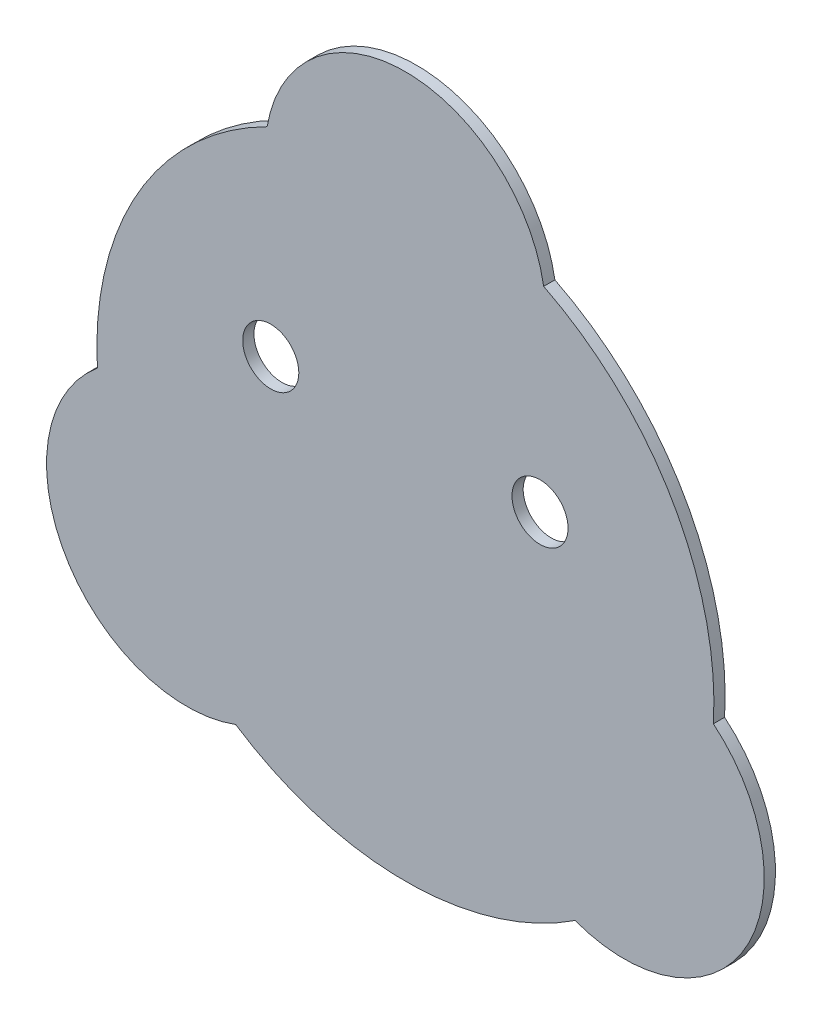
SolidWorks part; units mm, degrees
ref_plane "Спереди" through (0, 0, 0) normal (0, 0, 1) x (1, 0, 0)
ref_plane "Сверху" through (0, 0, 0) normal (0, 1, 0) x (1, 0, 0)
ref_plane "Справа" through (0, 0, 0) normal (1, 0, 0) x (0, 0, -1)
sketch "Эскиз1" plane through (0, 0, -2001) normal (0, 0, 1) x (1, 0, 0)
  circle A21 centre (-422.1166, 1329.8801) radius 2.5 construction
  circle A22 centre (-446.1166, 1329.8801) radius 2.5 construction
  circle A23 centre (-422.1166, 1329.8801) radius 2.5
  circle A24 centre (-446.1166, 1329.8801) radius 2.5
  arc A27 (-449.2438, 1299.9146) -> (-418.9894, 1299.9146) centre (-434.1166, 1322.8801) ccw
  arc A28 (-418.9894, 1299.9146) -> (-406.6642, 1321.2624) centre (-414.631, 1311.6301) ccw
  arc A29 (-406.6642, 1321.2624) -> (-421.7914, 1347.4635) centre (-434.1166, 1322.8801) ccw
  arc A30 (-461.569, 1321.2624) -> (-449.2438, 1299.9146) centre (-453.6022, 1311.6301) ccw
  arc A31 (-421.7914, 1347.4635) -> (-446.4417, 1347.4635) centre (-434.1166, 1345.3801) ccw
  arc A32 (-446.4417, 1347.4635) -> (-461.569, 1321.2624) centre (-434.1166, 1322.8801) ccw
  arc A33 (-449.2438, 1299.9146) -> (-418.9894, 1299.9146) centre (-434.1166, 1322.8801) ccw
  arc A34 (-418.9894, 1299.9146) -> (-406.6642, 1321.2624) centre (-414.631, 1311.6301) ccw
  arc A35 (-406.6642, 1321.2624) -> (-421.7914, 1347.4635) centre (-434.1166, 1322.8801) ccw
  arc A36 (-461.569, 1321.2624) -> (-449.2438, 1299.9146) centre (-453.6022, 1311.6301) ccw
  arc A37 (-421.7914, 1347.4635) -> (-446.4417, 1347.4635) centre (-434.1166, 1345.3801) ccw
  arc A38 (-446.4417, 1347.4635) -> (-461.569, 1321.2624) centre (-434.1166, 1322.8801) ccw
  dimension "D1" = 0.2
extrude "Бобышка-Вытянуть1" add sketch "Эскиз1" along normal blind 1
